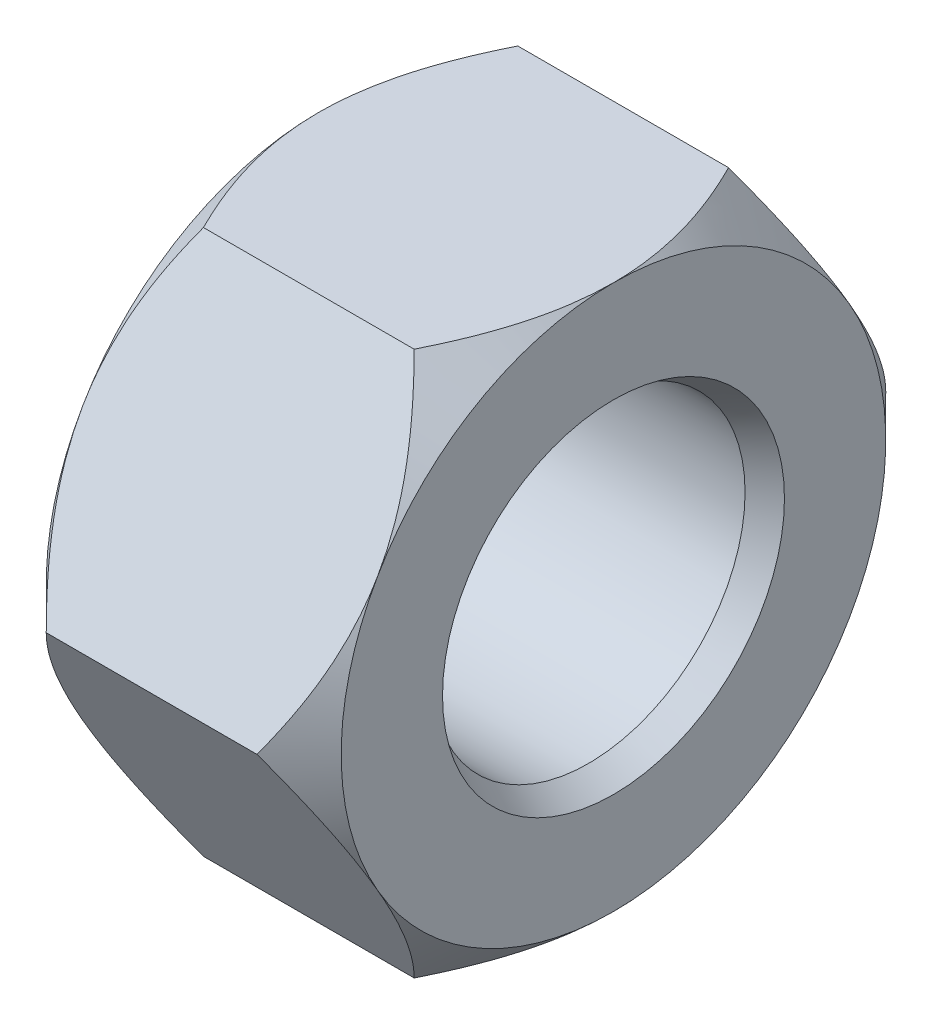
SolidWorks part; units mm, degrees
ref_plane "Plan de face" through (0, 0, 0) normal (0, 0, 1) x (1, 0, 0)
ref_plane "Plan de dessus" through (0, 0, 0) normal (0, 1, 0) x (1, 0, 0)
ref_plane "Plan de droite" through (0, 0, 0) normal (1, 0, 0) x (0, 0, -1)
sketch "Esquisse1" plane through (0, 0, 0) normal (0, 0, 1) x (1, 0, 0)
  line L0 (-26.7036, 0) -> (42.1872, 0) construction
  line L1 (0, 12) -> (0, 6.9)
  line L2 (0, 6.9) -> (13, 6.9)
  line L3 (13, 6.9) -> (13, 12)
  line L4 (13, 12) -> (7.5, 17.5)
  line L5 (7.5, 17.5) -> (5.5, 17.5)
  line L6 (5.5, 17.5) -> (0, 12)
  dimension "D1" = 13.8
  dimension "D2" = 13
  dimension "D3" = 24
  dimension "D4" = 45
  dimension "D5" = 45
  dimension "D6" = 35
revolve "Volume" add sketch "Esquisse1" angle 360 about L0
sketch "Esquisse2" plane through (0, 0, 0) normal (-1, 0, 0) x (0, 0, 1)
  line L1 (6.9282, -12) -> (13.8564, 0)
  line L2 (13.8564, 0) -> (6.9282, 12)
  line L3 (6.9282, 12) -> (-6.9282, 12)
  line L4 (-6.9282, 12) -> (-13.8564, 0)
  line L5 (-13.8564, 0) -> (-6.9282, -12)
  line L6 (-6.9282, -12) -> (6.9282, -12)
  circle A0 centre (0, 0) radius 12 construction
  circle A1 centre (0, 0) radius 12 construction
extrude "Profil hexagonal" cut sketch "Esquisse2" against normal through all flip side to cut
chamfer "Chanfrein1" distance 1.1 angle 30 2 edges at (0, 0, 6.9) (13, 0, 6.9)
